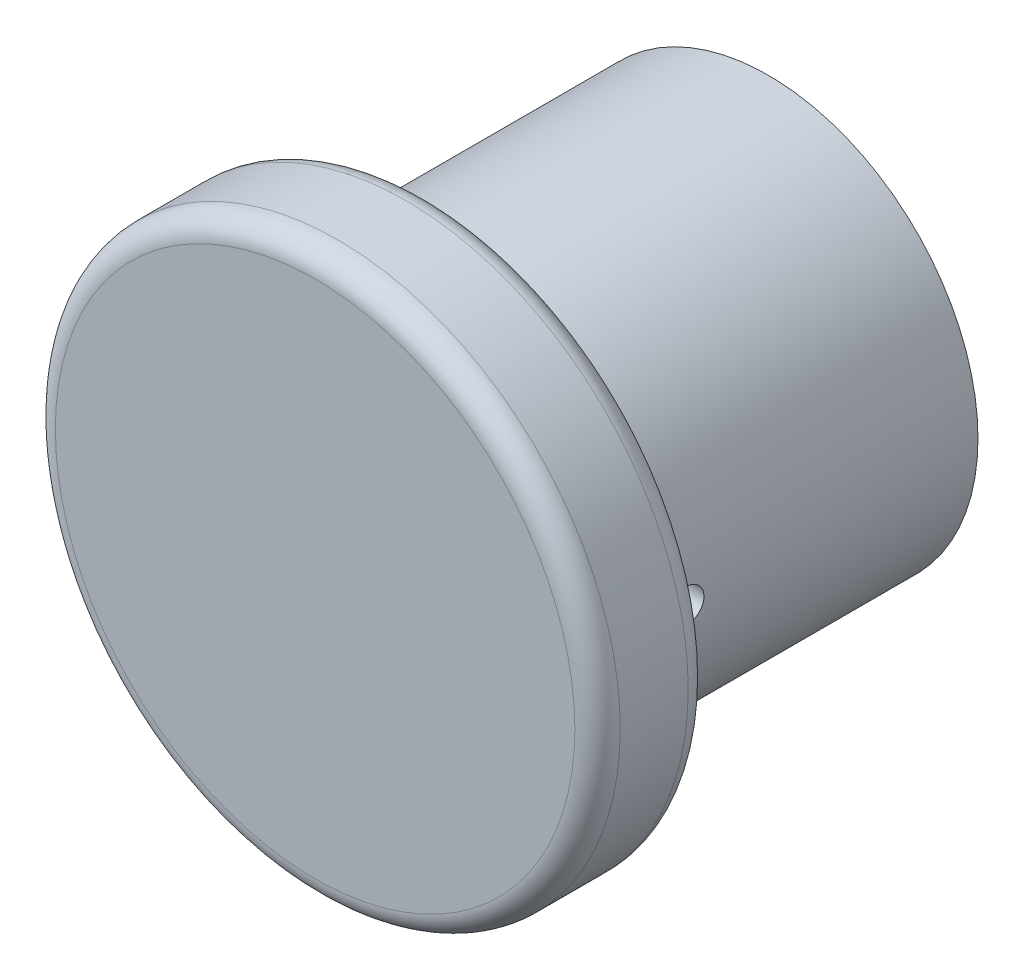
SolidWorks part; units mm, degrees
ref_plane "Front" through (0, 0, 0) normal (0, 0, 1) x (1, 0, 0)
ref_plane "Top" through (0, 0, 0) normal (0, 1, 0) x (1, 0, 0)
ref_plane "Right" through (0, 0, 0) normal (1, 0, 0) x (0, 0, -1)
revolve "Cut-Revolve1" cut sketch "Sketch3" angle 360 about L4
sketch "Sketch3" plane through (0, 0, 0) normal (0, -1, 0) x (1, 0, 0)
  line L0 (6.4135, -1.2733) -> (0, -1.2733)
  line L1 (0, -1.2733) -> (0, -15)
  line L2 (0, -15) -> (6.4135, -15)
  line L3 (6.4135, -15) -> (6.4135, -1.2733)
  line L4 (0, -1.2733) -> (0, -15) construction
ref_plane "Plane1" through (0, 0, 0) normal (0, 0, -1) x (-1, 0, 0)
sketch "Sketch1" plane through (0, 0, 0) normal (0, 0, -1) x (-1, 0, 0)
  circle A0 centre (0, 0) radius 12.4614
extrude "Base-Extrude" add sketch "Sketch1" against normal blind 5
sketch "Sketch2" plane through (0, 0, 0) normal (0, 0, -1) x (-1, 0, 0)
  circle A0 centre (0, 0) radius 9.2462
extrude "Boss-Extrude1" add sketch "Sketch2" along normal blind 15
ref_plane "Plane2" through (0, 0, 0) normal (0, -1, 0) x (1, 0, 0)
sketch "Sketch4" plane through (0, 0, 0) normal (0, 1, 0) x (1, 0, 0)
  line L0 (-6.3709, 2.1708) -> (-6.3709, 2.909)
  line L1 (-6.3709, 2.909) -> (-9.2462, 2.909)
  line L2 (-9.2462, 2.909) -> (-9.2462, 2.1708)
  line L3 (-9.2462, 2.1708) -> (-6.3709, 2.1708)
  line L4 (-9.2462, 2.1708) -> (-6.3709, 2.1708) construction
revolve "Cut-Revolve2" cut sketch "Sketch4" angle 360 about L4
sketch "Sketch5" plane through (0, 0, 0) normal (0, 1, 0) x (1, 0, 0)
  line L0 (9.2462, 2.1708) -> (9.2462, 2.909)
  line L1 (9.2462, 2.909) -> (6.3709, 2.909)
  line L2 (6.3709, 2.909) -> (6.3709, 2.1708)
  line L3 (6.3709, 2.1708) -> (9.2462, 2.1708)
  line L4 (6.3709, 2.1708) -> (9.2462, 2.1708) construction
revolve "Cut-Revolve3" cut sketch "Sketch5" angle 360 about L4
fillet "Fillet1" radius 1 3 edges at (12.4614, 0, 0) (12.4614, 0, 5) (9.2462, 0, 0)
